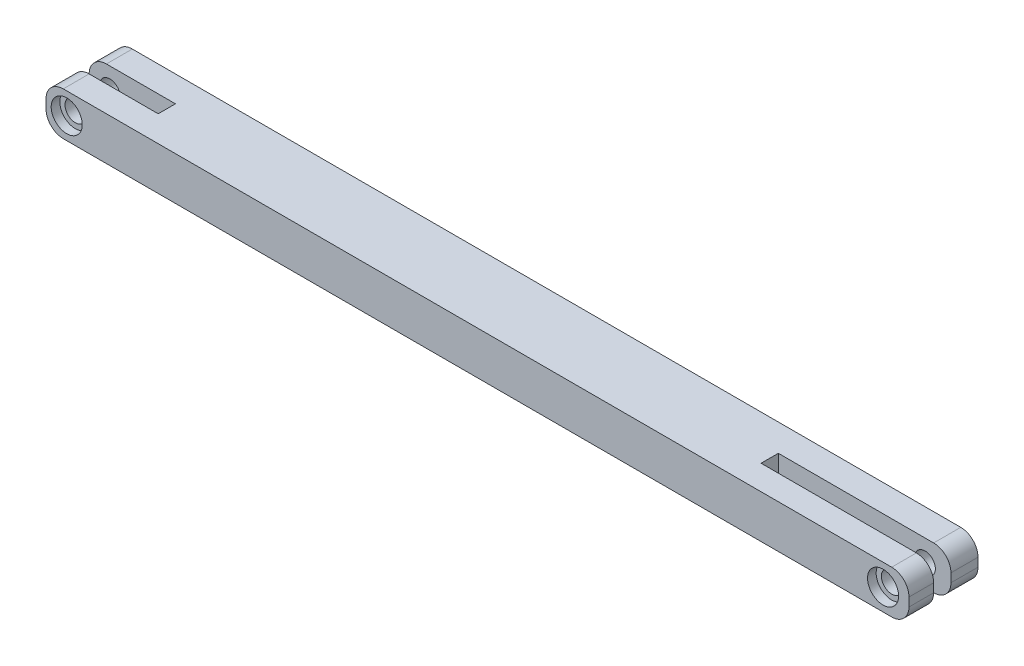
SolidWorks part; units mm, degrees
ref_plane "Front Plane" through (0, 0, 0) normal (0, 0, 1) x (1, 0, 0)
ref_plane "Top Plane" through (0, 0, 0) normal (0, 1, 0) x (1, 0, 0)
ref_plane "Right Plane" through (0, 0, 0) normal (1, 0, 0) x (0, 0, -1)
sketch "Sketch1" plane through (0, 0, 0) normal (0, 0, 1) x (1, 0, 0)
  line L1 (10, 0) -> (490, 0)
  line L2 (0, 10) -> (0, 15)
  line L3 (10, 25) -> (490, 25)
  line L4 (500, 10) -> (500, 15)
  arc A0 (0, 15) -> (10, 25) centre (10, 15) cw
  arc A1 (10, 0) -> (0, 10) centre (10, 10) cw
  circle A2 centre (485, 12.5) radius 6
  arc A3 (500, 15) -> (490, 25) centre (490, 15) ccw
  arc A4 (500, 10) -> (490, 0) centre (490, 10) cw
  point P9 (0, 0)
  dimension "D1" = 10
  dimension "D2" = 10
  dimension "D3" = 10
  dimension "D4" = 10
extrude "Boss-Extrude2" add sketch "Sketch1" along normal blind 40
sketch "Sketch2" plane through (0, 0, 0) normal (-1, 0, 0) x (0, 0, 1)
  line L0 (40, 25) -> (0, 25) construction
  line L1 (15, 25) -> (25, 25)
  line L2 (15, 25) -> (15, 0)
  line L3 (15, 0) -> (25, 0)
  line L4 (25, 25) -> (25, 0)
  line L5 (40, 0) -> (0, 0) construction
extrude "Cut-Extrude1" cut sketch "Sketch2" against normal blind 50
sketch "Sketch4" plane through (0, 0, 40) normal (0, 0, 1) x (1, 0, 0)
  circle A0 centre (12, 12.5) radius 9
sketch "Sketch5" plane through (500, 0, 0) normal (1, 0, 0) x (0, 0, -1)
  line L0 (-40, 25) -> (0, 25) construction
  line L1 (-25.6935, 25) -> (-15.6935, 25)
  line L2 (-25.6935, 25) -> (-25.6935, 0)
  line L3 (-25.6935, 0) -> (-15.6935, 0)
  line L4 (-15.6935, 25) -> (-15.6935, 0)
  line L5 (-40, 0) -> (0, 0) construction
extrude "Cut-Extrude3" cut sketch "Sketch5" against normal blind 100
extrude "Cut-Extrude4" cut sketch "Sketch4" against normal blind 5 contours A0
sketch "Sketch6" plane through (0, 0, 35) normal (0, 0, 1) x (1, 0, 0)
  circle A0 centre (12, 12.5) radius 6
sketch "Sketch8" plane through (0, 0, 40) normal (0, 0, 1) x (1, 0, 0)
  circle A0 centre (485, 12.5) radius 9
extrude "Cut-Extrude7" cut sketch "Sketch8" against normal blind 5
sketch "Sketch9" plane through (0, 0, 0) normal (0, 0, -1) x (-1, 0, 0)
  circle A0 centre (-485, 12.5) radius 9
extrude "Cut-Extrude8" cut sketch "Sketch9" against normal blind 5
extrude "Cut-Extrude9" cut sketch "Sketch6" against normal blind 10
sketch "Sketch10" plane through (0, 0, 0) normal (0, 0, -1) x (-1, 0, 0)
  circle A0 centre (-12, 12.5) radius 9
extrude "Cut-Extrude10" cut sketch "Sketch10" against normal blind 5
sketch "Sketch11" plane through (0, 0, 5) normal (0, 0, -1) x (-1, 0, 0)
  circle A0 centre (-12, 12.5) radius 6
extrude "Cut-Extrude11" cut sketch "Sketch11" against normal blind 10
